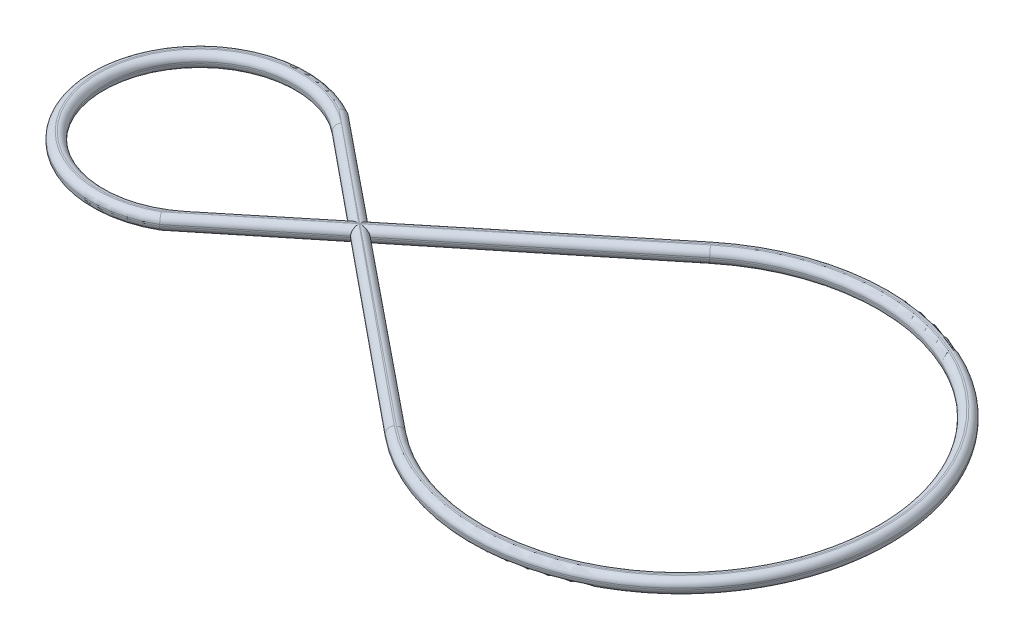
SolidWorks part; units mm, degrees
ref_plane "Plan de face" through (0, 0, 0) normal (0, 0, 1) x (1, 0, 0)
ref_plane "Plan de dessus" through (0, 0, 0) normal (0, 1, 0) x (1, 0, 0)
ref_plane "Plan de droite" through (0, 0, 0) normal (1, 0, 0) x (0, 0, -1)
sketch "Esquisse1" plane through (0, 0, 0) normal (0, 1, 0) x (1, 0, 0)
  line L0 (20.5572, 25.1724) -> (51.381, 0)
  line L1 (18.7083, 32.5) -> (55.0785, 3.0196)
  line L2 (18.7083, -32.5) -> (55.0785, -3.0196)
  line L3 (20.5572, -25.1724) -> (51.381, 0)
  line L4 (55.0785, 3.0196) -> (120.1416, 56.1538)
  line L5 (58.8038, 0) -> (123.4962, -52.4373)
  line L6 (58.8038, 0) -> (123.4962, 52.4373)
  line L7 (55.0785, -3.0196) -> (120.1416, -56.1538)
  arc A0 (20.5572, 25.1724) -> (20.5572, -25.1724) centre (0, 0) ccw
  arc A1 (18.7083, 32.5) -> (18.7083, -32.5) centre (0, 0) ccw
  arc A2 (123.4962, -52.4373) -> (123.4962, 52.4373) centre (166, 0) ccw
  arc A3 (120.1416, -56.1538) -> (120.1416, 56.1538) centre (166, 0) ccw
  dimension "D1" = 75
  dimension "D2" = 65
  dimension "D3" = 145
  dimension "D4" = 135
  dimension "D5" = 166
extrude "Extrusion1" add sketch "Esquisse1" along normal blind 5
fillet "Congé3" radius 2.25 24 edges at (36.8934, 5, -17.7598) (-37.5, 5, 0) (36.8934, 5, 17.7598) (-32.5, 0, 0) (35.9691, 0, 12.5862) (35.9691, 0, -12.5862) (87.61, 5, 29.5867) (-32.5, 5, 0) (35.9691, 5, 12.5862) (35.9691, 5, -12.5862) (233.5, 0, 0) (91.15, 0, -26.2187) (91.15, 0, 26.2187) (233.5, 5, 0) (91.15, 5, -26.2187) (91.15, 5, 26.2187) (238.5, 5, 0) (87.61, 0, 29.5867) (36.8934, 0, 17.7598) (-37.5, 0, 0) (36.8934, 0, -17.7598) (87.61, 5, -29.5867) (87.61, 0, -29.5867) (238.5, 0, 0)
